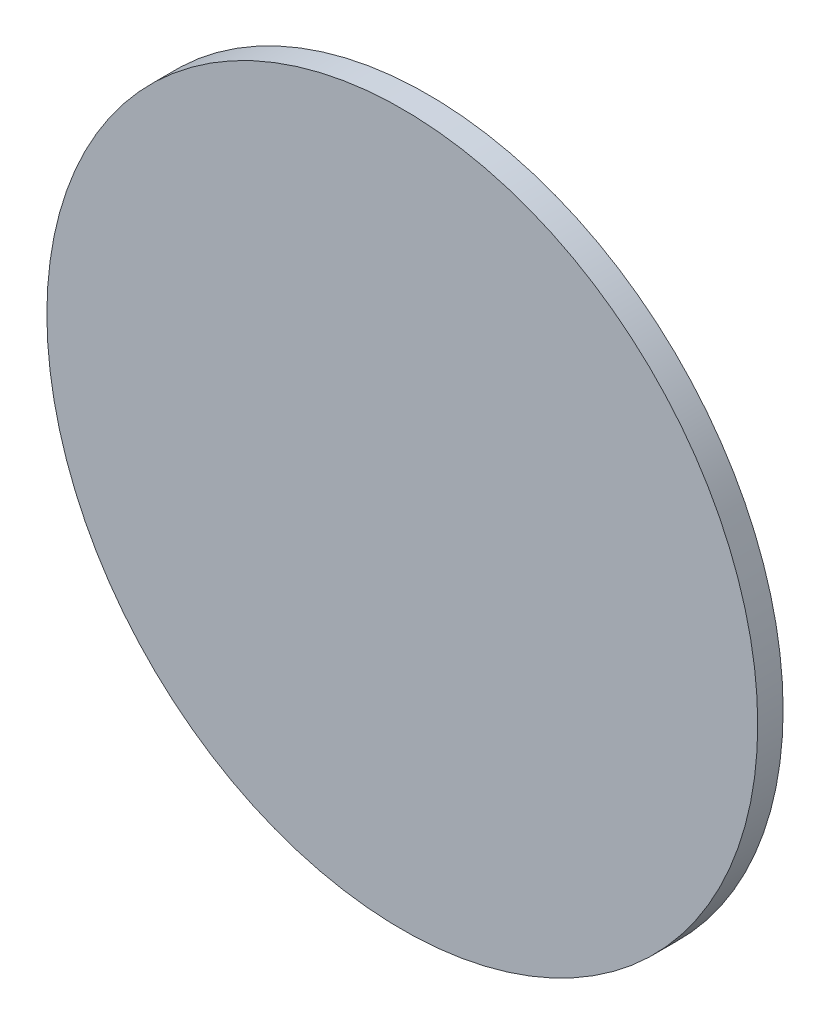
SolidWorks part; units mm, degrees
ref_plane "Alzado" through (0, 0, 0) normal (0, 0, 1) x (1, 0, 0)
ref_plane "Planta" through (0, 0, 0) normal (0, 1, 0) x (1, 0, 0)
ref_plane "Vista lateral" through (0, 0, 0) normal (1, 0, 0) x (0, 0, -1)
sketch "Croquis1" plane through (0, 0, 0) normal (0, 0, 1) x (1, 0, 0)
  circle A0 centre (0, 0) radius 14
extrude "Saliente-Extruir1" add sketch "Croquis1" along normal blind 1
